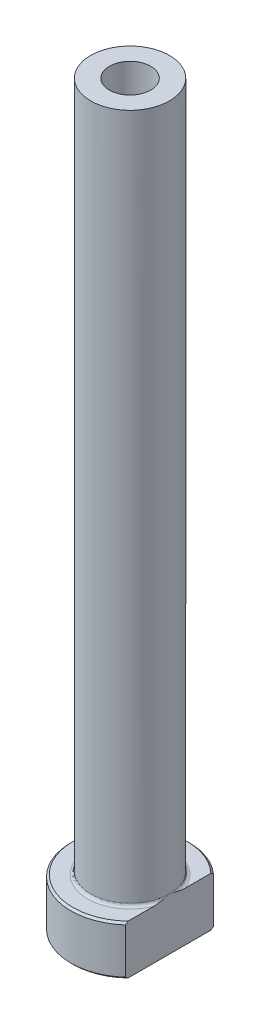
SolidWorks part; units mm, degrees
ref_plane "Front Plane" through (0, 0, 0) normal (0, 0, 1) x (1, 0, 0)
ref_plane "Top Plane" through (0, 0, 0) normal (0, 1, 0) x (1, 0, 0)
ref_plane "Right Plane" through (0, 0, 0) normal (1, 0, 0) x (0, 0, -1)
sketch "Sketch1" plane through (0, 0, 0) normal (0, 0, 1) x (1, 0, 0)
  line L0 (-2.1, 75) -> (-4, 75)
  line L1 (-4, 75) -> (-4, 5)
  line L2 (-4, 5) -> (-6, 5)
  line L3 (-6, 5) -> (-6, 0)
  line L4 (6.05, 0) -> (-6.05, 0) construction
  line L5 (-6, 0) -> (-2.35, 0)
  line L6 (-2.1, 30) -> (-2.1, 75)
  line L7 (0, 92.1877) -> (0, -15.5353) construction
  line L8 (0, -7.7) -> (0, 7.7) construction
  line L9 (-2.1, 30) -> (-2.35, 18)
  line L10 (-2.35, 18) -> (-2.35, 0)
  dimension "D1" = 0.25
  dimension "ID" = 4.2
  dimension "OD" = 8
  dimension "L" = 75
  dimension "H" = 12
  dimension "T" = 5
  dimension "N" = 45
  dimension "D2" = 12
  dimension "L-N" = 30
revolve "Revolve1" add sketch "Sketch1" angle 360 about L7
fillet "Fillet1" radius 0.3 1 edges at (0, 5, 4)
chamfer "Chamfer1" distance 0.2 angle 45 2 edges at (0, 5, 6) (0, 0, 6)
sketch "Sketch2" plane through (0, 0, 0) normal (0, -1, 0) x (1, 0, 0)
  line L0 (4, 4.4721) -> (4, -4.4721)
  circle A0 centre (0, 0) radius 6 construction
  arc A1 (4, 4.4721) -> (4, -4.4721) centre (0, 0) cw
  circle A2 centre (0, 0) radius 4 construction
extrude "Cut-Extrude1" cut sketch "Sketch2" against normal through all
chamfer "Chamfer2" distance 0.5 angle 45 1 edges at (0, 0, 2.35)
